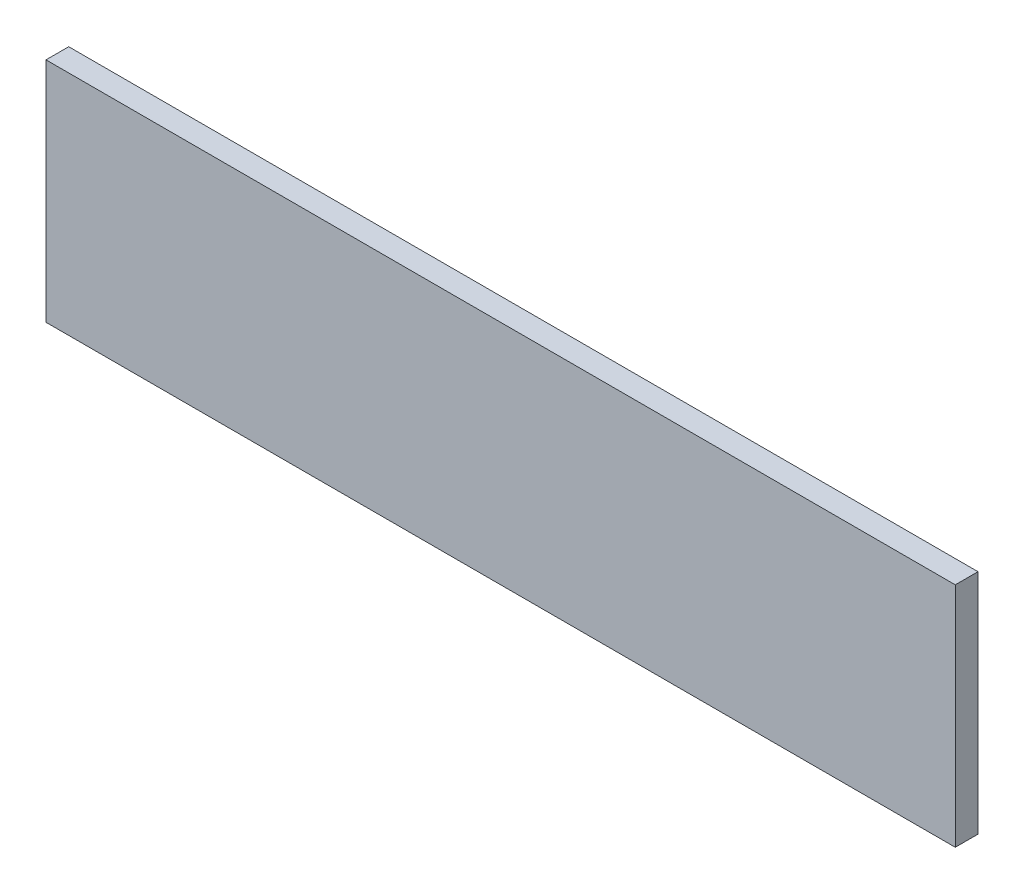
SolidWorks part; units mm, degrees
ref_plane "前视基准面" through (0, 0, 0) normal (0, 0, 1) x (1, 0, 0)
ref_plane "上视基准面" through (0, 0, 0) normal (0, 1, 0) x (1, 0, 0)
ref_plane "右视基准面" through (0, 0, 0) normal (1, 0, 0) x (0, 0, -1)
sketch "草图1" plane through (0, 0, 0) normal (0, 0, 1) x (1, 0, 0)
  line L0 (0, 55.1308) -> (0, -82.0865) construction
  line L1 (-120, -30) -> (120, -30)
  line L2 (-120, -30) -> (-120, 30)
  line L3 (-120, 30) -> (120, 30)
  line L4 (120, -30) -> (120, 30)
  line L5 (0, 0) -> (239.5665, 0) construction
  dimension "D1" = 60
  dimension "D2" = 240
extrude "拉伸1" add sketch "草图1" along normal mid plane 6
